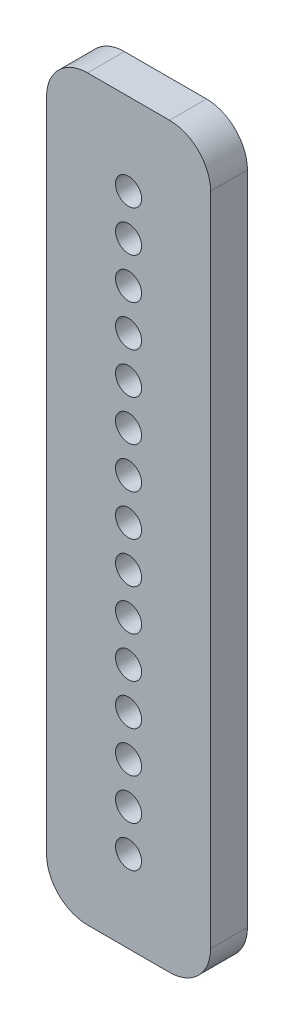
SolidWorks part; units mm, degrees
ref_plane "Front Plane" through (0, 0, 0) normal (0, 0, 1) x (1, 0, 0)
ref_plane "Top Plane" through (0, 0, 0) normal (0, 1, 0) x (1, 0, 0)
ref_plane "Right Plane" through (0, 0, 0) normal (1, 0, 0) x (0, 0, -1)
sketch "Sketch1" plane through (0, 0, 0) normal (0, 0, 1) x (1, 0, 0)
  line L1 (-12.7, 57.15) -> (12.7, 57.15)
  line L2 (-12.7, 57.15) -> (-12.7, -57.15)
  line L3 (-12.7, -57.15) -> (12.7, -57.15)
  line L4 (12.7, 57.15) -> (12.7, -57.15)
  line L5 (-12.7, 57.15) -> (12.7, -57.15) construction
  line L6 (-12.7, -57.15) -> (12.7, 57.15) construction
  point P0 (0, 0)
  dimension "D1" = 25.4
  dimension "D2" = 114.3
extrude "Boss-Extrude1" add sketch "Sketch1" along normal blind 5.715
sketch "Sketch2" plane through (0, 0, 5.715) normal (0, 0, 1) x (1, 0, 0)
  line L0 (0, 0) -> (0, 6.35) construction
  circle A0 centre (0, 0) radius 2.0193
  circle A1 centre (0, 6.35) radius 2.0193
  circle A2 centre (0, 12.7) radius 2.0193
  circle A3 centre (0, 19.05) radius 2.0193
  circle A4 centre (0, 25.4) radius 2.0193
  circle A5 centre (0, 31.75) radius 2.0193
  circle A6 centre (0, 38.1) radius 2.0193
  circle A7 centre (0, 44.45) radius 2.0193
  circle A8 centre (0, -6.35) radius 2.0193
  circle A9 centre (0, -12.7) radius 2.0193
  circle A10 centre (0, -19.05) radius 2.0193
  circle A11 centre (0, -25.4) radius 2.0193
  circle A12 centre (0, -31.75) radius 2.0193
  circle A13 centre (0, -38.1) radius 2.0193
  circle A14 centre (0, -44.45) radius 2.0193
  dimension "D1" = 4.0386
  dimension "D2" = 6.35
extrude "Cut-Extrude1" cut sketch "Sketch2" against normal blind 5.715
fillet "Fillet1" radius 6.35 4 edges at (12.7, -57.15, 2.8575) (-12.7, -57.15, 2.8575) (12.7, 57.15, 2.8575) (-12.7, 57.15, 2.8575)
